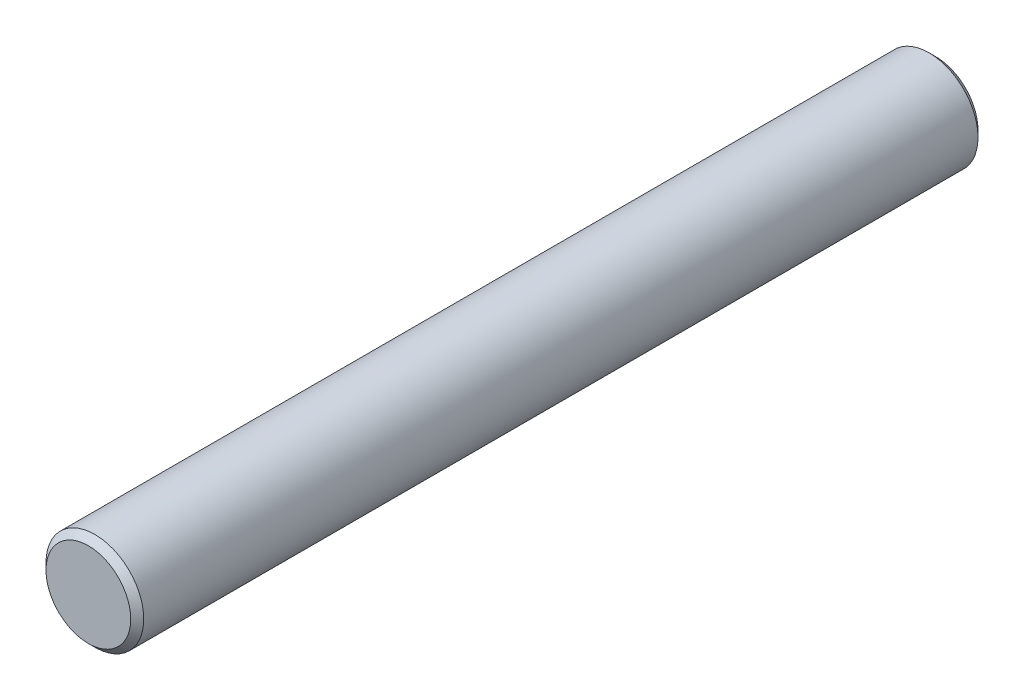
SolidWorks part; units mm, degrees
ref_plane "Face" through (0, 0, 0) normal (0, 0, 1) x (1, 0, 0)
ref_plane "Dessus" through (0, 0, 0) normal (0, 1, 0) x (1, 0, 0)
ref_plane "Droite" through (0, 0, 0) normal (1, 0, 0) x (0, 0, -1)
sketch "Esquisse1" plane through (0, 0, 0) normal (0, 0, 1) x (1, 0, 0)
  circle A0 centre (0, 0) radius 1.5
  dimension "D1" = 3
extrude "Cylindre de base" add sketch "Esquisse1" along normal mid plane 26
chamfer "Chanfrein1" distance 0.2 angle 45
